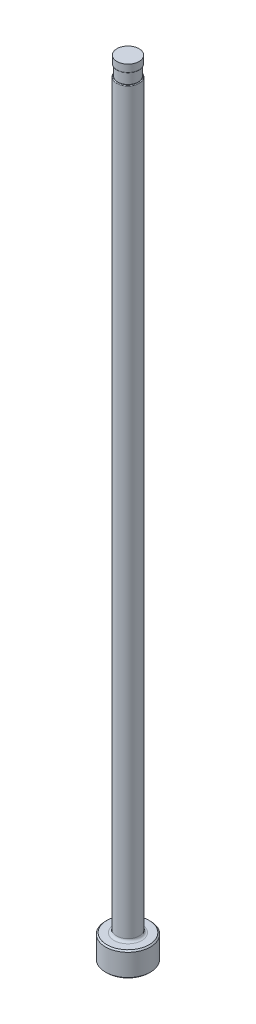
SolidWorks part; units mm, degrees
ref_plane "Front Plane" through (0, 0, 0) normal (0, 0, 1) x (1, 0, 0)
ref_plane "Top Plane" through (0, 0, 0) normal (0, 1, 0) x (1, 0, 0)
ref_plane "Right Plane" through (0, 0, 0) normal (1, 0, 0) x (0, 0, -1)
other "Configuration Table"
sketch "Sketch1" plane through (0, 0, 0) normal (0, 0, 1) x (1, 0, 0)
  line L0 (0, 259.9588) -> (0, -15.1925) construction
  line L1 (0, 0) -> (-4.3561, 0)
  line L2 (-4.3561, 0) -> (-4.3561, 4.7498)
  line L3 (-4.3561, 4.7498) -> (-2.1819, 4.7498)
  line L4 (-2.1819, 4.7498) -> (-2.1819, 152.4)
  line L5 (-2.1819, 152.4) -> (0, 152.4)
  line L6 (0, 152.4) -> (0, 0)
  dimension "L" = 152.4
  dimension "H" = 8.7122
  dimension "T" = 4.7498
  dimension "D" = 4.3637
revolve "Revolve1" add sketch "Sketch1" angle 360 about L0
chamfer "Chamfer1" distance 0.254 angle 45 2 edges at (0, 4.7498, 4.3561) (0, 0, 4.3561)
fillet "Fillet1" radius 0.508 1 edges at (0, 4.7498, 2.1819)
sketch "Sketch2" plane through (0, 0, 0) normal (0, 0, 1) x (1, 0, 0)
  line L0 (-2.1819, 152.4) -> (-2.1819, 5.2578) construction
  line L1 (-2.1819, 150.876) -> (-1.9787, 150.876)
  line L2 (-2.1819, 150.876) -> (-2.1819, 148.844)
  line L3 (-2.1819, 148.844) -> (-1.9787, 148.844)
  line L4 (-1.9787, 150.876) -> (-1.9787, 148.844)
  line L5 (2.1819, 152.4) -> (-2.1819, 152.4) construction
  line L6 (0, 153.4483) -> (0, 147.3282) construction
  dimension "D1" = 2.032
  dimension "N" = 1.524
  dimension "FD" = 0.2032
  dimension "D3" = 3.9573
revolve "Vent Relief" cut sketch "Sketch2" angle 360 about L6
sketch "Sketch3" plane through (0, 0, 0) normal (0, 0, 1) x (1, 0, 0)
  line L0 (-1.9787, 149.86) -> (-1.9787, 86.36)
  line L1 (-1.9787, 150.876) -> (-1.9787, 148.844) construction
  line L2 (-2.1819, 148.844) -> (-2.1819, 5.2578) construction
  line L3 (-2.1819, 85.2424) -> (-2.1819, 149.86)
  line L4 (-2.1819, 149.86) -> (-1.9787, 149.86)
  arc A0 (-1.9787, 86.36) -> (-2.1819, 85.2424) centre (-5.1537, 86.36) cw
  dimension "D1" = 3.175
  dimension "D2" = 63.5
extrude "D-Slot" cut sketch "Sketch3" against normal through all both and the other way through all
sketch "Sketch5" plane through (0, 0, 0) normal (0, 0, 1) x (1, 0, 0)
  line L0 (-2.1819, 150.876) -> (2.1819, 150.876) construction
  line L1 (-2.1819, 152.4) -> (-2.1565, 152.4)
  line L2 (-2.1819, 152.4) -> (-2.1819, 150.876)
  line L3 (-2.1819, 150.876) -> (-2.1565, 150.876)
  line L4 (-2.1565, 152.4) -> (-2.1565, 150.876)
  line L5 (0, 152.6877) -> (0, 150.5771) construction
  dimension "VP" = 0.0254
revolve "Vent Diameter" cut sketch "Sketch5" angle 360 about L5
fillet "Fillet2" radius 0.127 2 edges at (2.1819, 148.844, 0) (0, 150.876, 2.1565)
sketch "Pocket Sketch" plane through (0, 0, 0) normal (0, 0, 1) x (1, 0, 0)
  line L0 (-4.753, 0) -> (-4.753, 4.7752)
  line L1 (-4.753, 4.7752) -> (-3.1423, 4.7752)
  line L2 (-2.3803, 5.5372) -> (-2.3803, 22.225)
  line L3 (-2.3803, 22.225) -> (0, 22.225)
  line L4 (0, 22.225) -> (0, 0)
  line L5 (0, 0) -> (-4.753, 0)
  line L6 (0, 12.6104) -> (0, -2.4989) construction
  line L7 (-4.3561, 4.4958) -> (-4.3561, 0.254) construction
  line L8 (4.1021, 4.7498) -> (-4.1021, 4.7498) construction
  line L9 (-2.1819, 85.2424) -> (-2.1819, 5.2578) construction
  line L10 (-3.1423, 4.7752) -> (-2.3803, 5.5372)
  point P3 (-2.3803, 4.7752)
  dimension "D1" = 9.5059
  dimension "D2" = 0.3969
  dimension "D3" = 0.0254
  dimension "D4" = 0.1984
  dimension "D5" = 4.7606
  dimension "D6" = 22.225
